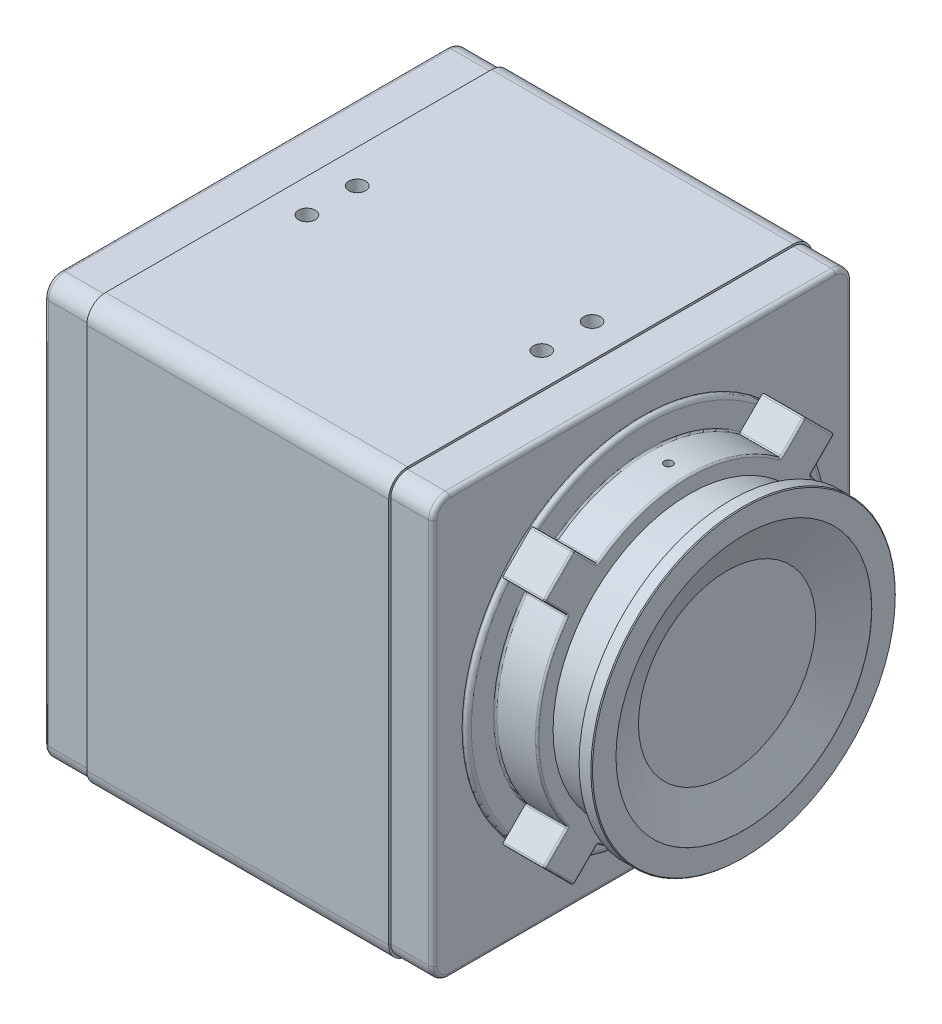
SolidWorks part; units mm, degrees
ref_plane "Front Plane" through (0, 0, 0) normal (0, 0, 1) x (1, 0, 0)
ref_plane "Top Plane" through (0, 0, 0) normal (0, 1, 0) x (1, 0, 0)
ref_plane "Right Plane" through (0, 0, 0) normal (1, 0, 0) x (0, 0, -1)
sketch "Sketch1" plane through (0, 0, 0) normal (0, 1, 0) x (1, 0, 0)
  line L1 (-23, -25) -> (23, -25)
  line L2 (-23, -25) -> (-23, 25)
  line L3 (-23, 25) -> (23, 25)
  line L4 (23, -25) -> (23, 25)
  point P8 (23, 0)
  point P10 (0, 25)
  dimension "D1" = 50
  dimension "D2" = 46
extrude "Height" add sketch "Sketch1" along normal mid plane 50
fillet "Fillet1" radius 2 4 edges at (0, 25, -25) (0, -25, -25) (0, -25, 25) (0, 25, 25)
sketch "Sketch3" plane through (0, 0, 0) normal (1, 0, 0) x (0, 0, -1)
  line L4 (25, -23) -> (25, 23)
  line L5 (23, 25) -> (-23, 25)
  line L6 (-25, 23) -> (-25, -23)
  line L7 (-23, -25) -> (23, -25)
  line L8 (25, -23) -> (25, 23)
  line L9 (23, 25) -> (-23, 25)
  line L10 (-25, 23) -> (-25, -23)
  line L11 (-23, -25) -> (23, -25)
  arc A4 (25, 23) -> (23, 25) centre (23, 23) ccw
  arc A5 (-23, 25) -> (-25, 23) centre (-23, 23) ccw
  arc A6 (-25, -23) -> (-23, -25) centre (-23, -23) ccw
  arc A7 (23, -25) -> (25, -23) centre (23, -23) ccw
  arc A8 (25, 23) -> (23, 25) centre (23, 23) ccw
  arc A9 (-23, 25) -> (-25, 23) centre (-23, 23) ccw
  arc A10 (-25, -23) -> (-23, -25) centre (-23, -23) ccw
  arc A11 (23, -25) -> (25, -23) centre (23, -23) ccw
  dimension "D1" = 0
sketch "Sketch5" plane through (0, 0, 0) normal (0, 1, 0) x (1, 0, 0)
  line L0 (23, -23) -> (23, 23) construction
  line L1 (-18, 25.25) -> (18, 25.25)
  line L2 (-18, 25.25) -> (-18, 25)
  line L3 (-18, 25) -> (18, 25)
  line L4 (18, 25.25) -> (18, 25)
  line L5 (-23, 23) -> (-23, -23) construction
  line L6 (18, 25.125) -> (-18, 25.125) construction
  line L7 (-23, 25) -> (23, 25) construction
  line L10 (-23, 25) -> (-23.25, 25)
  line L11 (-23, 25) -> (-23, 24.75)
  line L12 (-23, 24.75) -> (-23.25, 24.75)
  line L13 (-23.25, 25) -> (-23.25, 24.75)
sweep "Sweep2" add profiles "Sketch5" path "Sketch3"
fillet "Fillet2" radius 0.5 17 edges at (-23.25, 24.4142, 24.4142) (-23.25, 0, 25) (-23.25, -24.4142, 24.4142) (-23.25, -25, 0) (-23.25, -24.4142, -24.4142) (-23.25, -11.5, -25) (-23.25, 11.5, -25) (-23.25, 24.4142, -24.4142) (-23.25, 25, 0) (23, 24.4142, 24.4142) (23, 0, 25) (23, -24.4142, 24.4142) (23, -25, 0) (23, -24.4142, -24.4142) (23, 0, -25) (23, 24.4142, -24.4142) (23, 25, 0)
sketch "Sketch6" plane through (23, 0, 0) normal (1, 0, 0) x (0, 0, -1)
  line L0 (-23, -24.5) -> (23, -24.5) construction
  circle A0 centre (0, 0) radius 21.5
  point P5 (0, -24.5)
  dimension "D1" = 43
extrude "Boss-Extrude2" add sketch "Sketch6" along normal blind 0.6
fillet "Fillet3" radius 0.5 1 edges at (23.6, 0, -21.5)
sketch "Sketch7" plane through (23.6, 0, 0) normal (1, 0, 0) x (0, 0, -1)
  line L0 (-24.591, 24.591) -> (24.591, -24.591) construction
  line L1 (-17.3079, 13.7723) -> (-14.4794, 10.9439)
  line L2 (-17.3079, 13.7723) -> (-13.7723, 17.3079)
  line L4 (-13.7723, 17.3079) -> (-10.9439, 14.4794)
  line L5 (-17.3079, 13.7723) -> (-10.9439, 14.4794) construction
  line L6 (-14.4794, 10.9439) -> (-13.7723, 17.3079) construction
  line L7 (17.3079, 13.7723) -> (14.4794, 10.9439)
  line L8 (13.7723, 17.3079) -> (17.3079, 13.7723)
  line L9 (13.7723, 17.3079) -> (10.9439, 14.4794)
  line L10 (13.7723, -17.3079) -> (10.9439, -14.4794)
  line L11 (17.3079, -13.7723) -> (13.7723, -17.3079)
  line L12 (17.3079, -13.7723) -> (14.4794, -10.9439)
  line L13 (-17.3079, -13.7723) -> (-14.4794, -10.9439)
  line L14 (-13.7723, -17.3079) -> (-17.3079, -13.7723)
  line L15 (-13.7723, -17.3079) -> (-10.9439, -14.4794)
  circle A0 centre (0, 0) radius 20.1328 construction
  arc A1 (-14.4794, 10.9439) -> (-14.4794, -10.9439) centre (0, 0) ccw
  arc A2 (-23, 25.25) -> (-25.25, 23) centre (-23, 23) ccw construction
  arc A3 (23, -25.25) -> (25.25, -23) centre (23, -23) ccw construction
  arc A4 (10.9439, 14.4794) -> (-10.9439, 14.4794) centre (0, 0) ccw
  arc A5 (14.4794, -10.9439) -> (14.4794, 10.9439) centre (0, 0) ccw
  arc A6 (-10.9439, -14.4794) -> (10.9439, -14.4794) centre (0, 0) ccw
  point P9 (-14.1259, 14.1259)
  point P11 (-12.3581, 15.8936)
  point P33 (0, 0)
extrude "Boss-Extrude3" add sketch "Sketch7" along normal blind 5
fillet "Fillet4" radius 0.2 36 edges at (28.6, -15.8936, 12.3581) (28.6, -15.5401, 15.5401) (28.6, -12.3581, 15.8936) (26.1, -17.3079, -13.7723) (28.6, -15.5401, -15.5401) (26.1, -13.7723, -17.3079) (26.1, 17.3079, -13.7723) (26.1, 13.7723, -17.3079) (28.6, 15.5401, -15.5401) (26.1, 17.3079, 13.7723) (26.1, 13.7723, 17.3079) (28.6, 15.5401, 15.5401) (26.1, 14.4794, -10.9439) (26.1, 14.4794, 10.9439) (23.6, 18.15, 0) (26.1, -10.9439, -14.4794) (26.1, 10.9439, -14.4794) (23.6, 0, -18.15) (26.1, -14.4794, 10.9439) (26.1, -14.4794, -10.9439) (23.6, -18.15, 0) (26.1, 10.9439, 14.4794) (26.1, -10.9439, 14.4794) (23.6, 0, 18.15) (28.6, 12.3581, 15.8936) (28.6, 15.8936, 12.3581) (28.6, 18.15, 0) (28.6, 15.8936, -12.3581) (28.6, 12.3581, -15.8936) (28.6, 0, -18.15) (28.6, -12.3581, -15.8936) (28.6, -15.8936, -12.3581) (28.6, -18.15, 0) (28.6, 0, 18.15) (26.1, -13.7723, 17.3079) (26.1, -17.3079, 13.7723)
sketch "Sketch8" plane through (28.6, 0, 0) normal (1, 0, 0) x (0, 0, -1)
  circle A0 centre (0, 0) radius 16.25
  dimension "D1" = 32.5
extrude "Boss-Extrude4" add sketch "Sketch8" along normal blind 5
sketch "Sketch9" plane through (33.6, 0, 0) normal (1, 0, 0) x (0, 0, -1)
  circle A0 centre (0, 0) radius 18.15
extrude "Boss-Extrude5" add sketch "Sketch9" along normal blind 1.5
fillet "Fillet5" radius 0.2 1 edges at (33.6, 0, -16.25)
chamfer "Chamfer1" distance 0.1 angle 45 1 edges at (35.1, 0, -18.15)
sketch "Sketch10" plane through (35.1, 0, 0) normal (1, 0, 0) x (0, 0, -1)
  circle A0 centre (0, 0) radius 15.25
  dimension "D1" = 30.5
extrude "Cut-Extrude1" cut sketch "Sketch10" against normal blind 2 draft 7
sketch "Sketch12" plane through (0, -25.25, 0) normal (0, -1, 0) x (1, 0, 0)
  line L0 (19, 12) -> (19, -12)
  line L1 (19, -12) -> (5.7, -12)
  line L2 (19, 12) -> (5.7, 12)
  line L3 (18, -23) -> (18, 23) construction
  arc A0 (5.7, 12) -> (5.7, -12) centre (5.7, 0) ccw
  point P5 (-6.3, 0)
  point P6 (19, 0)
  dimension "D1" = 25.3
  dimension "D2" = 24
  dimension "D3" = 1
extrude "Boss-Extrude6" [suppressed] add sketch "Sketch12" along normal blind 5
chamfer "Chamfer3" distance 2 angle 60 1 edges at (33.1, 0, -15.0044)
sketch "Sketch17" plane through (-23, 0, 0) normal (-1, 0, 0) x (0, 0, 1)
  line L0 (-23, -25.25) -> (23, -25.25) construction
  circle A0 centre (0, -9.25) radius 5
  dimension "D1" = 16
  dimension "D2" = 10
extrude "Boss-Extrude7" add sketch "Sketch17" along normal blind 1
fillet "Fillet6" radius 1 1 edges at (-24, -9.25, 5)
sketch "Sketch18" plane through (-24, 0, 0) normal (-1, 0, 0) x (0, 0, 1)
  circle A0 centre (0, -9.25) radius 1.8
  dimension "D1" = 3.6
extrude "Boss-Extrude8" add sketch "Sketch18" along normal blind 10
sketch "Sketch19" plane through (0, 25.25, 0) normal (0, 1, 0) x (1, 0, 0)
  line L0 (0, 28.8579) -> (0, -28.8579) construction
  line L1 (-41.1917, 0) -> (41.1917, 0) construction
  line L2 (-18, -23) -> (-18, 23) construction
  line L3 (18, -23) -> (-18, -23) construction
  circle A0 centre (-14, -3) radius 1
  circle A1 centre (14, -3) radius 1
  circle A2 centre (14, 3) radius 1
  circle A3 centre (-14, 3) radius 1
  point P2 (-11.7777, -16.4643)
  point P6 (0, 0)
  point P10 (0, 0)
  dimension "D1" = 2
  dimension "D2" = 4
  dimension "D3" = 20
extrude "Cut-Extrude2" cut sketch "Sketch19" against normal blind 4
ref_plane "Plane1" through (0, 18.15, 0) normal (0, 1, 0) x (1, 0, 0)
sketch "Sketch20" plane through (0, 18.15, 0) normal (0, 1, 0) x (1, 0, 0)
  line L0 (28.4, 10.8059) -> (23.8, 10.8059) construction
  circle A0 centre (26.1, 0) radius 0.5
  point P2 (0, 0)
  point P3 (0, 0)
  point P5 (0, 0)
  point P6 (25.9964, 0)
  point P9 (26.1, 10.8059)
  dimension "D1" = 1
extrude "Cut-Extrude3" cut sketch "Sketch20" against normal up to surface (1.9077 mm away) contours A0
mirror "Mirror1" about plane through (0, 0, 0) normal (0, 1, 0) of "Cut-Extrude3"
sketch "Sketch21" plane through (0, -25.25, 0) normal (0, -1, 0) x (1, 0, 0)
  line L0 (-18, -23) -> (-18, 23) construction
  line L1 (18, 23) -> (-18, 23) construction
  line L2 (-49.9921, 0) -> (49.9921, 0) construction
  circle A0 centre (-14, 3) radius 1
  circle A1 centre (-14, -3) radius 1
  point P10 (0, 0)
  dimension "D3" = 2
  dimension "D1" = 4
  dimension "D2" = 20
extrude "Cut-Extrude4" cut sketch "Sketch21" against normal blind 4
equation "\"MainRadius\"=2"
equation "\"Side Radius@Fillet1\"=\"MainRadius\""
equation "\"SmallRadius\"=0.5"
equation "\"D1@Fillet2\"=\"SmallRadius\""
equation "\"D1@Fillet3\"=\"SmallRadius\""
equation "\"SmallestRadius\"=0.2"
equation "\"D1@Fillet4\"=\"SmallestRadius\""
equation "\"LensDia\"=36.3"
equation "\"Lens Diameter@Sketch7\"=\"LensDia\""
equation "\"D1@Sketch9\"=\"LensDia\""
equation "\"D1@Fillet5\"=\"SmallestRadius\""
equation "\"SweepProfile\"=0.25"
equation "\"SweepProfile@Sketch5\" = \"SweepProfile\""
equation "\"SweepProfile2@Sketch5\" = \"SweepProfile\""
